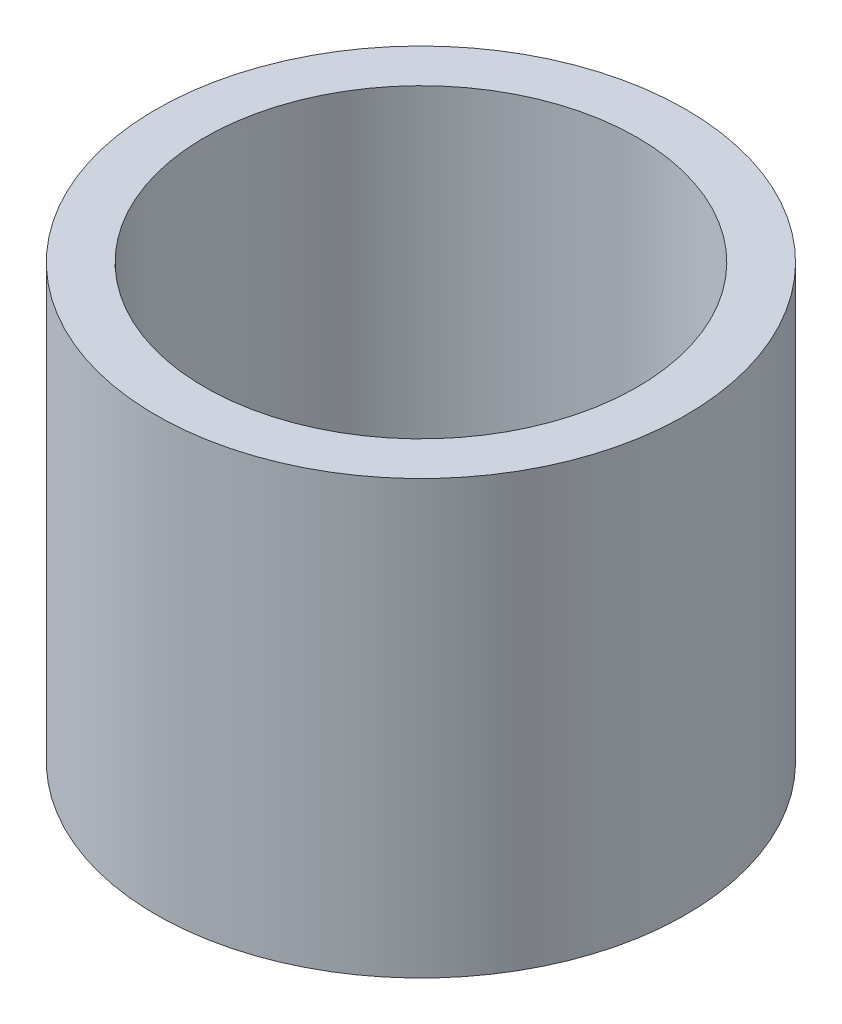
SolidWorks part; units mm, degrees
ref_plane "Front Plane" through (0, 0, 0) normal (0, 0, 1) x (1, 0, 0)
ref_plane "Top Plane" through (0, 0, 0) normal (0, 1, 0) x (1, 0, 0)
ref_plane "Right Plane" through (0, 0, 0) normal (1, 0, 0) x (0, 0, -1)
sketch "Sketch4" plane through (0, 0, 0) normal (0, 1, 0) x (1, 0, 0)
  circle A0 centre (0, 0) radius 28.2575
  circle A1 centre (0, 0) radius 34.6075
  dimension "D1" = 56.515
  dimension "D2" = 69.215
extrude "Boss-Extrude1" add sketch "Sketch4" along normal blind 56.515
